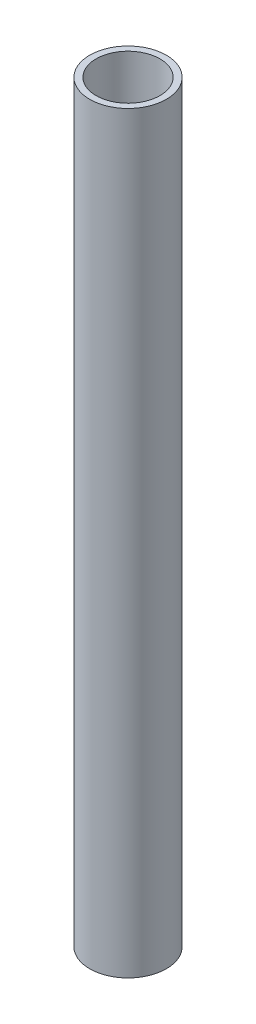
SolidWorks part; units mm, degrees
ref_plane "Front Plane" through (0, 0, 0) normal (0, 0, 1) x (1, 0, 0)
ref_plane "Top Plane" through (0, 0, 0) normal (0, 1, 0) x (1, 0, 0)
ref_plane "Right Plane" through (0, 0, 0) normal (1, 0, 0) x (0, 0, -1)
sketch "Sketch1" plane through (0, 0, 0) normal (0, 1, 0) x (1, 0, 0)
  circle A0 centre (0, 0) radius 15.875
  circle A1 centre (0, 0) radius 19.05
  dimension "D1" = 31.75
  dimension "D2" = 38.1
extrude "Boss-Extrude1" add sketch "Sketch1" along normal blind 374.65
